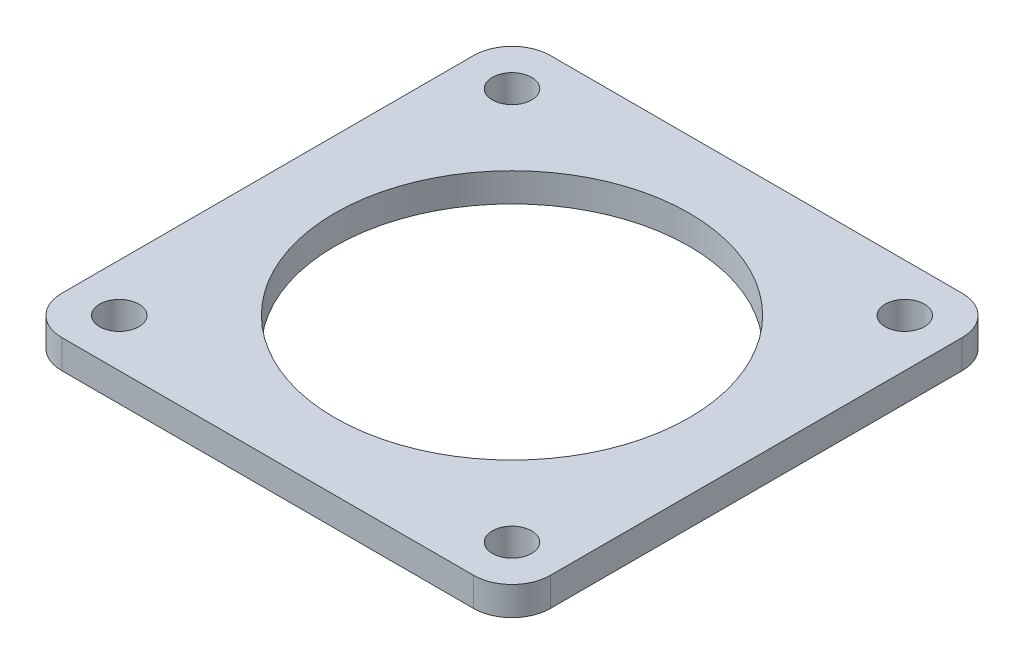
SolidWorks part; units mm, degrees
ref_plane "Front Plane" through (0, 0, 0) normal (0, 0, 1) x (1, 0, 0)
ref_plane "Top Plane" through (0, 0, 0) normal (0, 1, 0) x (1, 0, 0)
ref_plane "Right Plane" through (0, 0, 0) normal (1, 0, 0) x (0, 0, -1)
sketch "Sketch1" plane through (0, 0, 0) normal (0, 1, 0) x (1, 0, 0)
  line L1 (-25.5, -25.5) -> (25.5, -25.5)
  line L2 (-25.5, -25.5) -> (-25.5, 25.5)
  line L3 (-25.5, 25.5) -> (25.5, 25.5)
  line L4 (25.5, -25.5) -> (25.5, 25.5)
  line L5 (-25.5, -25.5) -> (25.5, 25.5) construction
  line L6 (-25.5, 25.5) -> (25.5, -25.5) construction
  point P0 (0, 0)
  dimension "D1" = 51
  dimension "D2" = 51
extrude "Boss-Extrude2" add sketch "Sketch1" along normal blind 3
sketch "Sketch5" plane through (0, 3, 0) normal (0, 1, 0) x (1, 0, 0)
  circle A0 centre (0, 0) radius 18.5
  dimension "D1" = 37
extrude "Cut-Extrude2" cut sketch "Sketch5" against normal through all
hole_wizard "Ø4.1 (4.1) Diameter Hole1" positions "Sketch7" profile "Sketch6" hole size "Ø4.1" standard "ANSI Metric"
sketch "Sketch7" plane through (0, 3, 0) normal (0, 1, 0) x (1, 0, 0)
  line L0 (-20.5, 20.5) -> (20.5, 20.5) construction
  line L1 (20.5, 20.5) -> (20.5, -20.5) construction
  line L2 (20.5, -20.5) -> (-20.5, -20.5) construction
  line L3 (-20.5, -20.5) -> (-20.5, 20.5) construction
  line L5 (-25.5, 20.5) -> (-20.5, 20.5) construction
  line L6 (-25.5, 25.5) -> (-25.5, -25.5) construction
  line L7 (-20.5, 20.5) -> (-20.5, 25.5) construction
  line L8 (25.5, 25.5) -> (-25.5, 25.5) construction
  line L10 (20.5, -25.5) -> (20.5, -20.5) construction
  line L11 (-25.5, -25.5) -> (25.5, -25.5) construction
  line L12 (20.5, -20.5) -> (25.5, -20.5) construction
  line L13 (25.5, -25.5) -> (25.5, 25.5) construction
  point P0 (-20.5, 20.5)
  point P2 (20.5, 20.5)
  point P4 (20.5, -20.5)
  point P6 (-20.5, -20.5)
  dimension "D1" = 5
sketch "Sketch6" plane through (-20.5, 3, -20.5) normal (1, 0, 0) x (0, 0, 1)
  line L0 (0, 0) -> (0, 3)
  line L1 (0, 3) -> (2.05, 3)
  line L2 (2.05, 3) -> (2.05, 0)
  line L5 (2.05, 0) -> (0, 0)
  line L11 (0, -6.35) -> (0, 107.95) construction
  dimension "Thru Hole Dia." = 4.1
  dimension "Thru Hole Depth" = 3
fillet "Fillet1" radius 4 4 edges at (25.5, 1.5, 25.5) (-25.5, 1.5, 25.5) (25.5, 1.5, -25.5) (-25.5, 1.5, -25.5)
